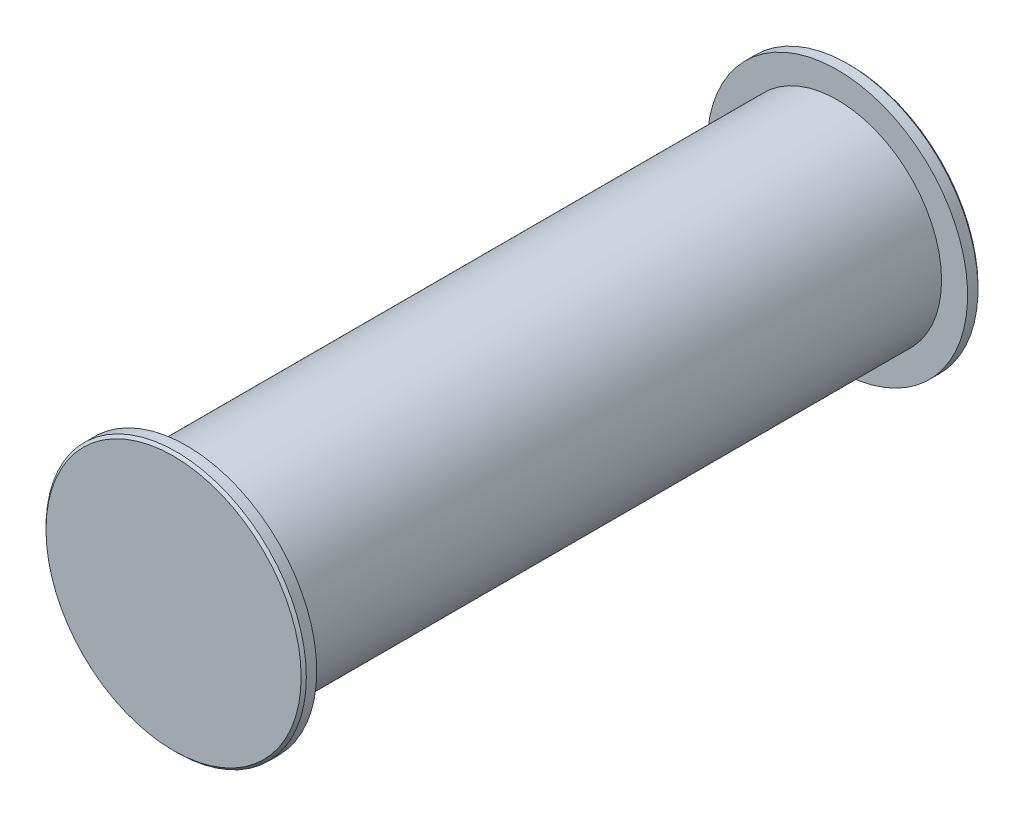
SolidWorks part; units mm, degrees
ref_plane "Plan1" through (0, 0, 0) normal (0, 0, 1) x (1, 0, 0)
ref_plane "Plan2" through (0, 0, 0) normal (0, 1, 0) x (1, 0, 0)
ref_plane "Plan3" through (0, 0, 0) normal (1, 0, 0) x (0, 0, -1)
sketch "Esquisse1" plane through (0, 0, 0) normal (0, 0, 1) x (1, 0, 0)
  circle A0 centre (0, 0) radius 4
  dimension "D1" = 8
extrude "Base-Extrusion" add sketch "Esquisse1" along normal blind 25
sketch "Esquisse2" plane through (0, 0, 25) normal (0, 0, 1) x (1, 0, 0)
  circle A0 centre (0, 0) radius 5
  dimension "D1" = 10
extrude "Boss.-Extru.1" add sketch "Esquisse2" along normal blind 0.5
chamfer "Chanfrein1" distance 0.1 angle 45
sketch "Esquisse3" plane through (0, 0, 0) normal (0, 0, -1) x (-1, 0, 0)
  circle A0 centre (0, 0) radius 5
  dimension "D1" = 10
extrude "Boss.-Extru.2" add sketch "Esquisse3" along normal blind 0.5
chamfer "Chanfrein2" distance 0.1 angle 45
